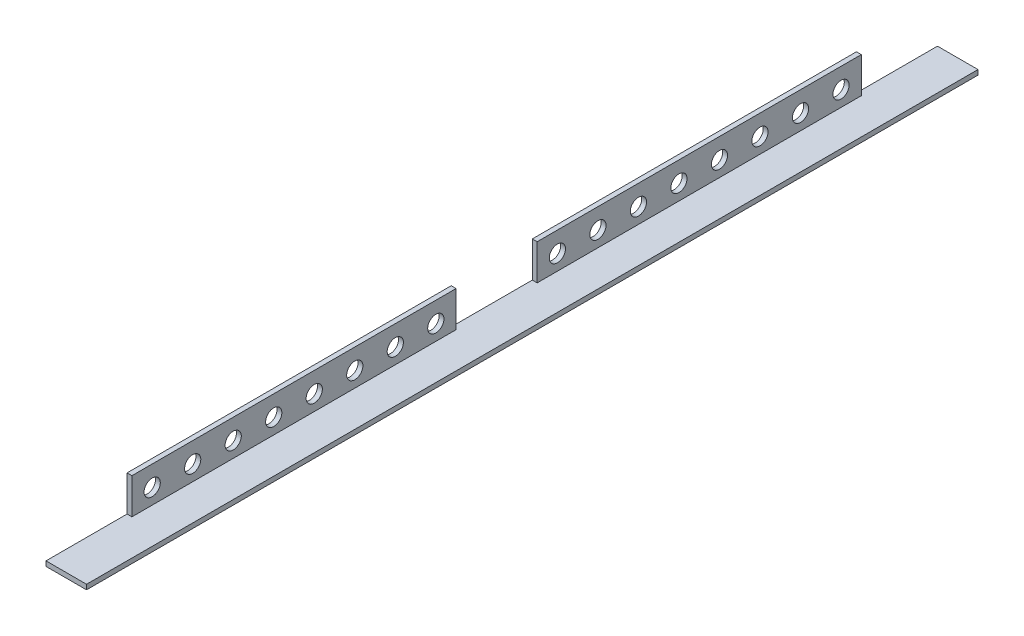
SolidWorks part; units mm, degrees
ref_plane "Front Plane" through (0, 0, 0) normal (0, 0, 1) x (1, 0, 0)
ref_plane "Top Plane" through (0, 0, 0) normal (0, 1, 0) x (1, 0, 0)
ref_plane "Right Plane" through (0, 0, 0) normal (1, 0, 0) x (0, 0, -1)
sketch "Sketch1" plane through (0, 0, 0) normal (0, 0, 1) x (1, 0, 0)
  line L0 (-43.1707, 0) -> (-43.1707, -25.4)
  line L1 (-43.1707, -25.4) -> (-17.7707, -25.4)
  line L2 (-43.1707, 0) -> (-40.1227, 0)
  line L3 (-40.1227, 0) -> (-40.1227, -22.352)
  line L4 (-40.1227, -22.352) -> (-17.7707, -22.352)
  line L5 (-17.7707, -22.352) -> (-17.7707, -25.4)
  dimension "D1" = 25.4
  dimension "D2" = 25.4
  dimension "D3" = 3.048
  dimension "D4" = 3.048
extrude "Boss-Extrude1" add sketch "Sketch1" along normal blind 558.8
sketch "Sketch2" plane through (-40.1227, 0, 0) normal (1, 0, 0) x (0, 0, -1)
  line L0 (-558.8, -22.352) -> (-508, -22.352)
  line L1 (-558.8, -22.352) -> (0, -22.352) construction
  line L2 (-508, -22.352) -> (-508, 0)
  line L3 (-558.8, 0) -> (0, 0) construction
  line L4 (-508, 0) -> (-558.8, 0)
  line L5 (-558.8, 0) -> (-558.8, -22.352)
  line L6 (-304.8, 0) -> (-304.8, -22.352)
  line L7 (-304.8, -22.352) -> (-254, -22.352)
  line L8 (-254, -22.352) -> (-254, 0)
  line L9 (-254, 0) -> (-304.8, 0)
  line L10 (0, 0) -> (0, -22.352)
  line L11 (0, -22.352) -> (-50.8, -22.352)
  line L12 (-50.8, -22.352) -> (-50.8, 0)
  line L13 (-50.8, 0) -> (0, 0)
  dimension "D1" = 50.8
  dimension "D2" = 50.8
  dimension "D3" = 203.2
  dimension "D4" = 50.8
extrude "Cut-Extrude1" cut sketch "Sketch2" against normal blind 558.8
sketch "Sketch3" plane through (-43.1707, 0, 0) normal (-1, 0, 0) x (0, 0, 1)
  line L0 (50.8, 0) -> (50.8, -22.352) construction
  line L1 (254, -22.352) -> (254, 0) construction
  line L2 (304.8, 0) -> (304.8, -22.352) construction
  line L4 (254, 0) -> (50.8, 0) construction
  line L7 (508, 0) -> (304.8, 0) construction
  circle A0 centre (63.5, -12.7) radius 5.08
  circle A1 centre (88.9, -12.7) radius 5.08
  circle A2 centre (114.3, -12.7) radius 5.08
  circle A3 centre (139.7, -12.7) radius 5.08
  circle A4 centre (165.1, -12.7) radius 5.08
  circle A5 centre (190.5, -12.7) radius 5.08
  circle A6 centre (215.9, -12.7) radius 5.08
  circle A7 centre (317.5, -12.7) radius 5.08
  circle A8 centre (342.9, -12.7) radius 5.08
  circle A9 centre (368.3, -12.7) radius 5.08
  circle A10 centre (393.7, -12.7) radius 5.08
  circle A11 centre (419.1, -12.7) radius 5.08
  circle A12 centre (444.5, -12.7) radius 5.08
  circle A13 centre (469.9, -12.7) radius 5.08
  circle A14 centre (495.3, -12.7) radius 5.08
  circle A15 centre (241.3, -12.7) radius 5.08
  dimension "D8" = 10.16
  dimension "D9" = 10.16
  dimension "D10" = 10.16
  dimension "D11" = 10.16
  dimension "D12" = 10.16
  dimension "D13" = 10.16
  dimension "D14" = 10.16
  dimension "D16" = 10.16
  dimension "D25" = 10.16
  dimension "D26" = 10.16
  dimension "D27" = 10.16
  dimension "D28" = 10.16
  dimension "D29" = 10.16
  dimension "D30" = 10.16
  dimension "D31" = 10.16
  dimension "D32" = 10.16
  dimension "D1" = 12.7
  dimension "D2" = 25.4
  dimension "D3" = 25.4
  dimension "D4" = 25.4
  dimension "D5" = 25.4
  dimension "D6" = 25.4
  dimension "D7" = 25.4
  dimension "D15" = 12.7
  dimension "D17" = 12.7
  dimension "D18" = 25.4
  dimension "D19" = 25.4
  dimension "D20" = 25.4
  dimension "D21" = 25.4
  dimension "D22" = 25.4
  dimension "D23" = 25.4
  dimension "D24" = 25.4
  dimension "D33" = 12.7
  dimension "D34" = 12.7
  dimension "D35" = 12.7
  dimension "D36" = 12.7
extrude "Cut-Extrude2" cut sketch "Sketch3" against normal blind 89.916
